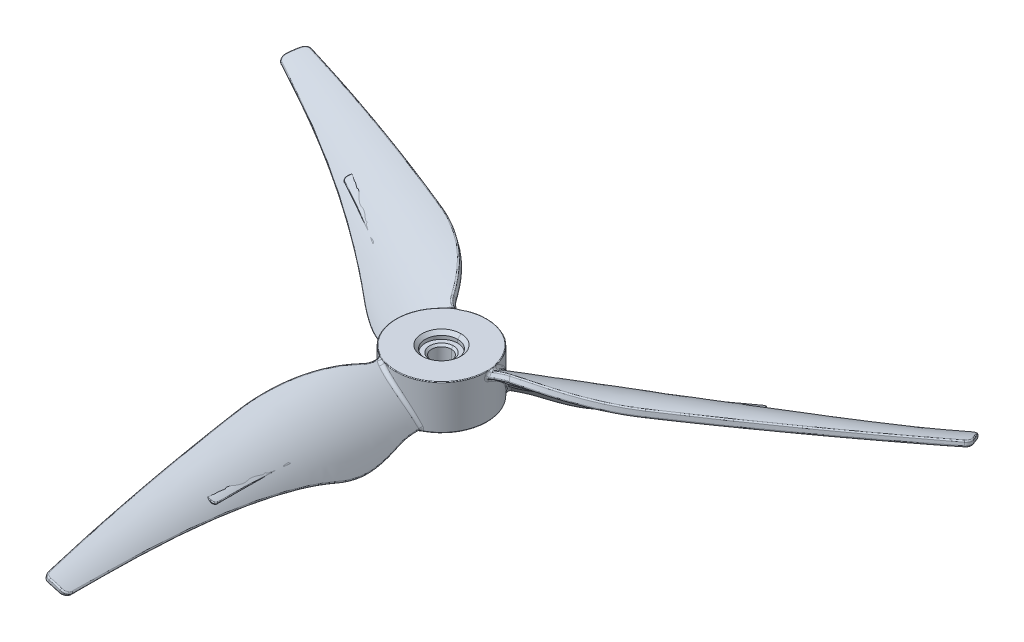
SolidWorks part; units mm, degrees
ref_plane "前视基准面" through (0, 0, 0) normal (0, 0, 1) x (1, 0, 0)
ref_plane "上视基准面" through (0, 0, 0) normal (0, 1, 0) x (1, 0, 0)
ref_plane "右视基准面" through (0, 0, 0) normal (1, 0, 0) x (0, 0, -1)
imported_body "Gemfan Propeller 51466.STEP<1>"
sketch "草图2" plane through (0, 3.4, 0) normal (0, 1, 0) x (1, 0, 0)
  line L0 (61.816, 31.4935) -> (61.816, -66.5412) construction
ref_plane "基准面5" through (61.816, 0, 0) normal (-1, 0, 0) x (0, 0, 1)
scale "缩放比例1" scale about centroid uniform scaling yes scale factor 1.5
scale "缩放比例2" bodies to scale 102 scale about centroid uniform scaling yes scale factor 1.1
